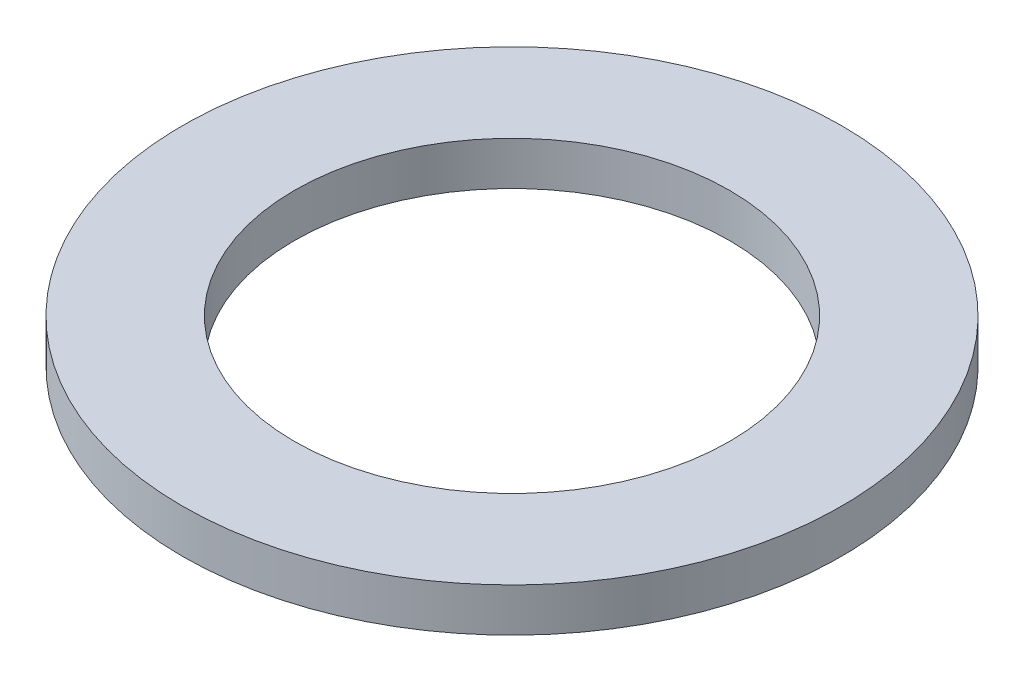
SolidWorks part; units mm, degrees
ref_plane "Front Plane" through (0, 0, 0) normal (0, 0, 1) x (1, 0, 0)
ref_plane "Top Plane" through (0, 0, 0) normal (0, 1, 0) x (1, 0, 0)
ref_plane "Right Plane" through (0, 0, 0) normal (1, 0, 0) x (0, 0, -1)
sketch "Sketch1" plane through (0, 0, 0) normal (0, 1, 0) x (1, 0, 0)
  circle A0 centre (0, 0) radius 10
  circle A1 centre (0, 0) radius 15.15
  dimension "D1" = 30.3
  dimension "D2" = 20
extrude "Boss-Extrude1" add sketch "Sketch1" along normal blind 2
